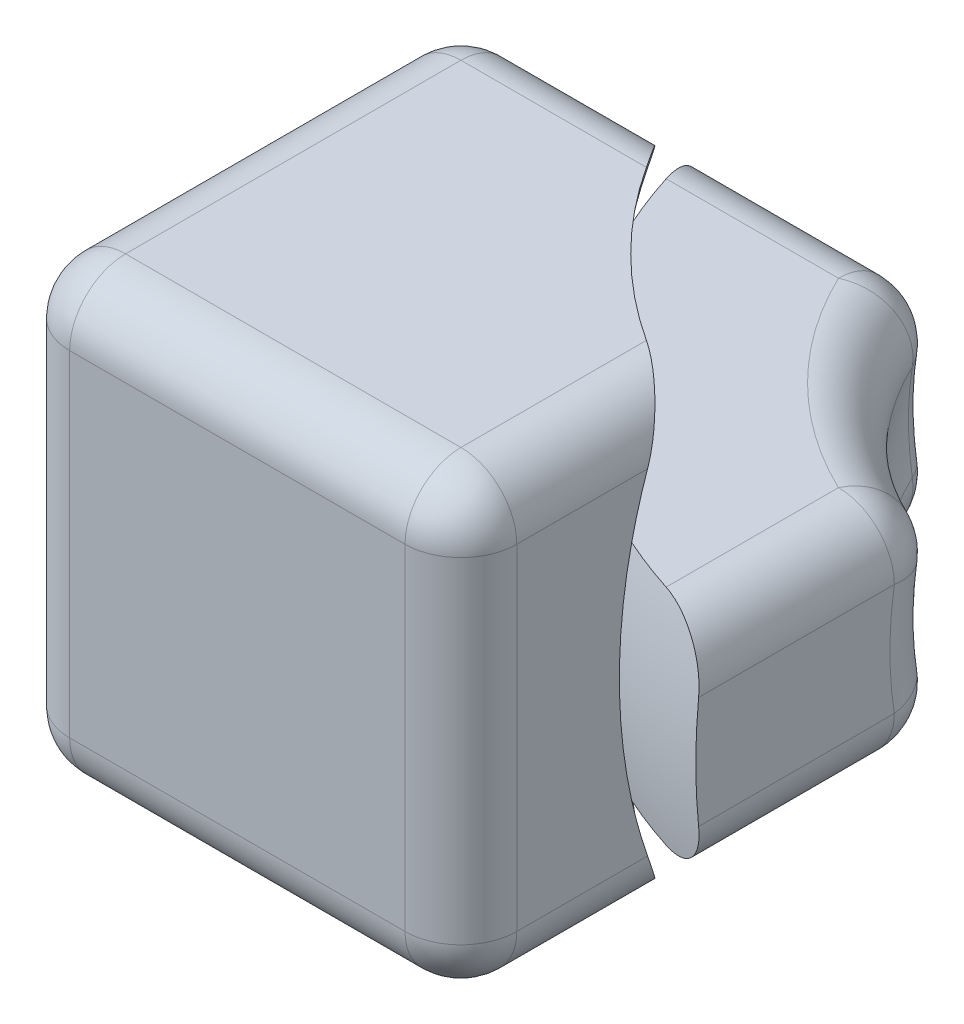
SolidWorks part; units mm, degrees
ref_plane "Front Plane" through (0, 0, 0) normal (0, 0, 1) x (1, 0, 0)
ref_plane "Top Plane" through (0, 0, 0) normal (0, 1, 0) x (1, 0, 0)
ref_plane "Right Plane" through (0, 0, 0) normal (1, 0, 0) x (0, 0, -1)
sketch "Sketch1" plane through (0, 0, 0) normal (0, 0, 1) x (1, 0, 0)
  line L1 (60, -60) -> (-60, -60)
  line L2 (60, -60) -> (60, 60)
  line L3 (60, 60) -> (-60, 60)
  line L4 (-60, -60) -> (-60, 60)
  line L5 (60, -60) -> (-60, 60) construction
  line L6 (60, 60) -> (-60, -60) construction
  point P0 (0, 0)
  dimension "D1" = 120
extrude "Boss-Extrude1" add sketch "Sketch1" along normal mid plane 120
sketch "Sketch2" plane through (0, 0, 0) normal (0, 0, 1) x (1, 0, 0)
  line L1 (50, -50) -> (-50, -50)
  line L2 (50, -50) -> (50, 50)
  line L3 (50, 50) -> (-50, 50)
  line L4 (-50, -50) -> (-50, 50)
  line L5 (50, -50) -> (-50, 50) construction
  line L6 (50, 50) -> (-50, -50) construction
  point P0 (0, 0)
  dimension "D1" = 100
extrude "Cut-Extrude1" cut sketch "Sketch2" against normal mid plane 100
sketch "Sketch3" plane through (0, 0, 0) normal (0, 0, 1) x (1, 0, 0)
  line L1 (0, 50) -> (0, 60)
  line L2 (0, -50) -> (0, -60)
  line L3 (60, 60) -> (-60, 60) construction
  line L4 (0, -50) -> (0, 50) construction
  arc A0 (0, 50) -> (0, -50) centre (0, 0) ccw
  arc A1 (0, 60) -> (0, -60) centre (0, 0) ccw
  point P6 (0, 0)
  dimension "D1" = 50
revolve "Revolve1" add sketch "Sketch3" angle 360 about L4
sketch "Sketch4" plane through (0, 0, 0) normal (0, 0, 1) x (1, 0, 0)
  line L0 (-20, 60) -> (-20, -60)
  line L1 (60, -60) -> (-60, -60)
  line L2 (60, -60) -> (60, 60)
  line L3 (60, 60) -> (-60, 60)
  line L4 (-60, -60) -> (-60, 60)
  line L5 (60, -60) -> (-60, 60) construction
  line L6 (60, 60) -> (-60, -60) construction
  line L8 (20, 60) -> (20, -60)
  line L10 (60, -20) -> (-60, -20)
  line L12 (60, 20) -> (-60, 20)
  point P0 (0, 0)
  dimension "D1" = 40
  dimension "D2" = 40
  dimension "D3" = 40
  dimension "D4" = 40
extrude "Cut-Extrude-Thin1" cut sketch "Sketch4" against normal through all both and the other way through all thin contours L0 L12 L4 L10
sketch "Sketch5" plane through (0, 0, 0) normal (0, 1, 0) x (1, 0, 0)
  line L0 (-20, 60) -> (-20, -60)
  line L1 (60, -60) -> (-60, -60)
  line L2 (60, -60) -> (60, 60)
  line L3 (60, 60) -> (-60, 60)
  line L4 (-60, -60) -> (-60, 60)
  line L5 (60, -60) -> (-60, 60) construction
  line L6 (60, 60) -> (-60, -60) construction
  line L8 (20, 60) -> (20, -60)
  line L10 (60, -20) -> (-60, -20)
  line L12 (60, 20) -> (-60, 20)
  point P0 (0, 0)
  dimension "D1" = 120
  dimension "D2" = 40
  dimension "D3" = 40
  dimension "D4" = 40
  dimension "D5" = 40
extrude "Cut-Extrude2" cut sketch "Sketch5" against normal through all both and the other way through all contours L0 L12 L4 L10 | L12 L0 L3 L4
sketch "Sketch7" plane through (0, 0, 0) normal (1, 0, 0) x (0, 0, -1)
  line L0 (0, -50) -> (0, 50) construction
  line L1 (0, 30) -> (0, 50)
  line L2 (0, -30) -> (0, -50)
  arc A0 (0, 50) -> (0, -50) centre (0, 0) ccw
  arc A1 (0, 30) -> (0, -30) centre (0, 0) ccw
  point P2 (0, 0)
  dimension "D1" = 50
  dimension "D2" = 30
revolve "Revolve2" add sketch "Sketch7" angle 360 about L0
sketch "Sketch9" plane through (0, 0, 0) normal (0, 0, 1) x (1, 0, 0)
  line L0 (-10, 48.9898) -> (-10, -48.9898)
  circle A0 centre (0, 0) radius 50 construction
  arc A1 (-10, -48.9898) -> (-10, 48.9898) centre (0, 0) ccw
  dimension "D1" = 10
extrude "Cut-Extrude3" cut sketch "Sketch9" against normal through all both and the other way through all
sketch "Sketch10" plane through (0, 0, 0) normal (1, 0, 0) x (0, 0, -1)
  line L0 (-10, 47.9583) -> (-10, -47.9583)
  circle A0 centre (0, 0) radius 48.9898 construction
  arc A1 (-10, -47.9583) -> (-10, 47.9583) centre (0, 0) ccw
  dimension "D1" = 10
extrude "Cut-Extrude4" cut sketch "Sketch10" against normal through all both and the other way through all
sketch "Sketch11" plane through (0, 0, 0) normal (1, 0, 0) x (0, 0, -1)
  line L0 (-47.9583, 10) -> (-10, 10)
  line L1 (-10, -26.4575) -> (-10, 26.4575) construction
  line L2 (-10, 10) -> (-10, 47.9583)
  line L3 (-47.9583, -10) -> (-10, -10)
  line L4 (-10, -10) -> (-10, -47.9583)
  arc A0 (-10, 47.9583) -> (-10, -47.9583) centre (0, 0) ccw construction
  arc A1 (-10, 47.9583) -> (-47.9583, 10) centre (0, 0) ccw
  arc A2 (-47.9583, -10) -> (-10, -47.9583) centre (0, 0) ccw
  dimension "D1" = 10
extrude "Cut-Extrude5" cut sketch "Sketch11" against normal up to surface (20 mm away)
sketch "Sketch12" plane through (0, 0, 0) normal (0, 0, 1) x (1, 0, 0)
  line L0 (-20, 10) -> (-47.9583, 10)
  line L1 (-20, 10) -> (-20, 44.7214)
  line L2 (-20, -10) -> (-47.9583, -10)
  line L3 (-20, -44.7214) -> (-20, -10)
  arc A0 (-20, 44.7214) -> (-20, -44.7214) centre (0, 0) ccw construction
  arc A1 (-20, 44.7214) -> (-47.9583, 10) centre (0, 0) ccw
  arc A2 (-47.9583, -10) -> (-20, -44.7214) centre (0, 0) ccw
extrude "Cut-Extrude6" cut sketch "Sketch12" along normal up to surface (20 mm away)
sketch "Sketch15" plane through (0, 0, 0) normal (0, 0, 1) x (1, 0, 0)
  line L0 (-26.4575, 10) -> (-47.9583, 10) construction
  line L1 (-48.9898, 10) -> (0, 10)
  line L2 (0, 10) -> (0, 50)
  arc A3 (-48.9898, 10) -> (0, 50) centre (0, 0) cw
  dimension "D1" = 50
revolve "Cut-Revolve1" cut sketch "Sketch15" angle 360 about L2
mirror "Mirror1" about plane through (0, 0, 0) normal (0, 1, 0) of "Cut-Revolve1"
fillet "Fillet1" radius 5 11 edges at (-60, 20, 40) (-60, -20, 40) (-60, 0, 20) (-60, 0, 60) (-40, 20, 60) (-20, 0, 60) (-40, -20, 60) (-50.6155, -20, 20) (-50.6155, 20, 20) (-20, -20, 50.6155) (-20, 20, 50.6155)
fillet "Fillet2" radius 5 8 edges at (-37.2079, -10, 10) (-37.2079, 10, 10) (-28.2843, 0, 10) (-10, 0, 28.2843) (-10, -10, 37.2079) (-10, 10, 37.2079) (-20, 10, 20) (-20, -10, 20)
sketch "Sketch19" plane through (0, 20, 0) normal (0, 1, 0) x (1, 0, 0)
  line L4 (-55, -55) -> (-25, -55)
  line L5 (-25, -55) -> (-25, -38.4057)
  line L6 (-38.4057, -25) -> (-55, -25)
  line L7 (-55, -25) -> (-55, -55)
  line L8 (-55, -55) -> (-25, -55)
  line L9 (-25, -55) -> (-25, -42.1307)
  line L10 (-42.1307, -25) -> (-55, -25)
  line L11 (-55, -25) -> (-55, -55)
  arc A0 (-44.7214, -20) -> (-20, -44.7214) centre (0, 0) ccw construction
  arc A1 (-38.4057, -25) -> (-25, -38.4057) centre (0, 0) ccw
  arc A3 (-42.1307, -25) -> (-25, -42.1307) centre (0, 0) ccw
  dimension "D1" = 0
extrude "Boss-Extrude2" add sketch "Sketch19" against normal up to surface (40 mm away)
scale "Scale1" scale about centroid uniform scaling yes scale factor 0.75
sketch "Sketch16" plane through (0, 0, 54.823) normal (0, 0, 1) x (1, 0, 0)
  line L0 (-39.823, 15) -> (-39.823, -15) construction
  line L1 (-51.073, 15) -> (-28.573, 15) construction
  line L2 (-28.573, -15) -> (-51.073, -15) construction
  line L4 (-54.823, -11.25) -> (-54.823, 11.25) construction
  line L5 (-54.823, 0) -> (-24.823, 0) construction
  line L6 (-24.823, 11.25) -> (-24.823, -11.25) construction
  point P12 (-39.823, 0)
  point P13 (-39.823, 0)
sketch "Sketch17" plane through (-54.823, 0, 0) normal (-1, 0, 0) x (0, 0, 1)
  line L0 (39.823, 15) -> (39.823, -15) construction
  line L1 (28.573, 15) -> (51.073, 15) construction
  line L2 (51.073, -15) -> (28.573, -15) construction
  line L4 (24.823, 7.5) -> (24.823, -7.5) construction
  line L5 (24.823, 0) -> (54.823, 0) construction
  line L7 (51.073, 11.25) -> (54.823, 11.25) construction
  line L8 (51.073, 11.25) -> (54.823, 11.25) construction
  point P10 (39.823, 0)
  point P11 (39.823, 0)
